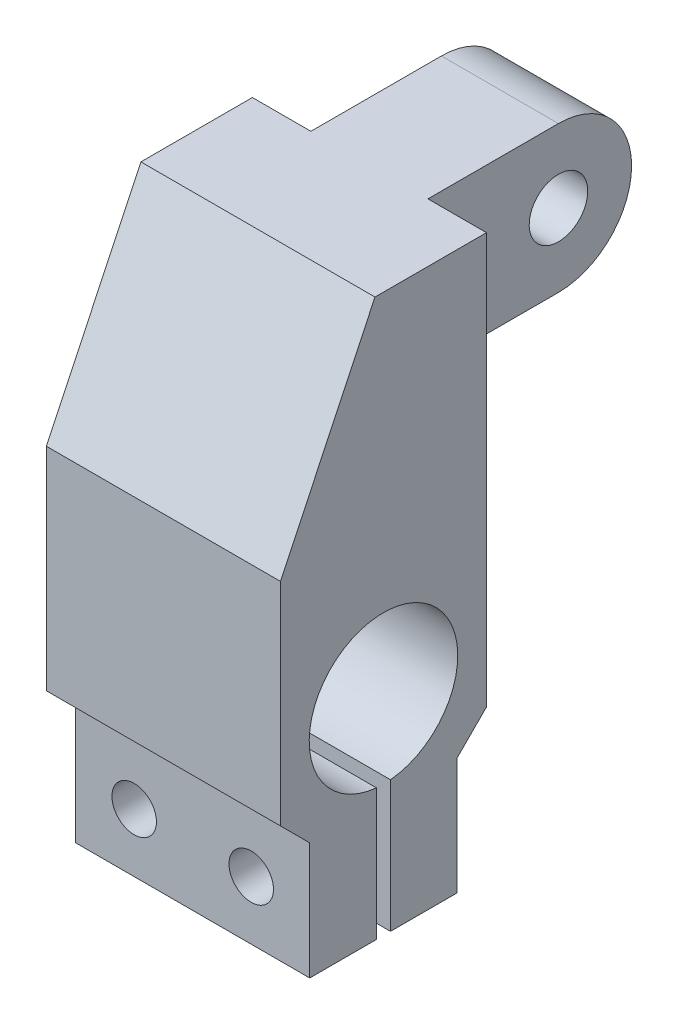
SolidWorks part; units mm, degrees
ref_plane "Plane1" through (0, 0, 0) normal (0, 0, 1) x (1, 0, 0)
ref_plane "Plane2" through (0, 0, 0) normal (0, 1, 0) x (1, 0, 0)
ref_plane "Plane3" through (0, 0, 0) normal (1, 0, 0) x (0, 0, -1)
sketch "Sketch1" plane through (0, 0, 0) normal (0, 0, 1) x (1, 0, 0)
  line L0 (0, 0) -> (25.4, 0)
  line L1 (0, 0) -> (0, 60.452)
  line L2 (25.4, 60.452) -> (0, 60.452)
  line L3 (25.4, 60.452) -> (25.4, 0)
  dimension "D1" = 25.4
  dimension "D2" = 60.452
extrude "Base-Extrude" add sketch "Sketch1" along normal blind 22.352
sketch "Sketch2" plane through (25.4, 0, 0) normal (1, 0, 0) x (0, 0, -1)
  line L0 (-12.9766, 58.6029) -> (-27.7372, 27.5171)
  line L1 (-27.7372, 27.5171) -> (-27.7372, 21.2602)
  line L2 (-27.7372, 21.2602) -> (-19.177, 12.7)
  line L3 (-19.177, 12.7) -> (-19.177, -3.6898)
  line L4 (-11.176, 0) -> (-11.176, 64.2807) construction
  line L5 (-22.352, 0) -> (0, 0) construction
  line L6 (-11.176, 0) -> (-11.176, -3.6898) construction
  line L7 (-22.352, 60.452) -> (0, 60.452) construction
  line L8 (-22.352, 60.452) -> (-22.352, 0) construction
  line L9 (-11.5072, 61.6974) -> (-35.0594, 61.6974)
  line L10 (-12.9766, 58.6029) -> (-11.7964, 61.0885)
  line L12 (11.4577, -3.6898) -> (-3.175, -3.6898)
  line L13 (-35.0594, 61.6974) -> (-33.8097, -3.6898)
  line L14 (-33.8097, -3.6898) -> (-19.177, -3.6898)
  line L15 (-3.175, 12.7) -> (-3.175, -3.6898)
  line L16 (-11.7964, 61.0885) -> (1.7437, 61.0885)
  line L17 (1.7437, 17.6187) -> (-3.175, 12.7)
  line L18 (12.7074, 61.6974) -> (11.4577, -3.6898)
  line L19 (-10.8448, 61.6974) -> (12.7074, 61.6974)
  line L20 (1.7437, 17.6187) -> (1.7437, 61.0885)
  line L21 (-10.8448, 61.6974) -> (-11.5072, 61.6974)
  circle A0 centre (-11.176, 22.2758) radius 8.0612
  dimension "D1" = 38.1762
  dimension "D2" = 25.4
  dimension "D3" = 3.175
  dimension "D4" = 12.7
extrude "Cut-Extrude1" cut sketch "Sketch2" against normal through all
sketch "Sketch3" plane through (25.4, 0, 0) normal (1, 0, 0) x (0, 0, -1)
  line L0 (-11.176, 22.2758) -> (-11.176, -3.2732) construction
  line L1 (-10.414, 15.875) -> (-10.414, -3.2732)
  line L2 (-11.938, 15.875) -> (-11.938, -3.2732)
  line L3 (-11.938, 15.875) -> (-10.414, 15.875)
  line L4 (-11.938, -3.2732) -> (-10.414, -3.2732)
  dimension "D1" = 0.762
extrude "Cut-Extrude2" cut sketch "Sketch3" against normal through all
sketch "Sketch4" plane through (0, 0, 0) normal (0, 0, -1) x (-1, 0, 0)
  line L0 (-12.7, 60.452) -> (-12.7, -4.3841) construction
  line L1 (-25.4, 60.452) -> (0, 60.452) construction
  line L2 (-19.05, 60.452) -> (-6.35, 60.452)
  line L3 (-19.05, 60.452) -> (-19.05, 44.577)
  line L4 (-6.35, 44.577) -> (-19.05, 44.577)
  line L5 (-6.35, 44.577) -> (-6.35, 60.452)
  dimension "D1" = 15.875
  dimension "D2" = 6.35
  dimension "D3" = 12.7
extrude "Boss-Extrude1" add sketch "Sketch4" along normal blind 22.098
sketch "Sketch5" plane through (19.05, 0, 0) normal (1, 0, 0) x (0, 0, -1)
  line L0 (22.098, 52.5145) -> (-4.0702, 52.5145) construction
  line L1 (22.098, 60.452) -> (22.098, 44.577) construction
  line L2 (14.1605, 44.577) -> (14.1605, 41.0095)
  line L3 (14.1605, 60.452) -> (14.1605, 62.4156)
  line L4 (14.1605, 62.4156) -> (23.0227, 62.4156)
  line L5 (23.0227, 62.4156) -> (23.0227, 41.0095)
  line L6 (23.0227, 41.0095) -> (14.1605, 41.0095)
  arc A0 (14.1605, 44.577) -> (14.1605, 60.452) centre (14.1605, 52.5145) ccw
  dimension "D1" = 15.875
extrude "Cut-Extrude3" cut sketch "Sketch5" against normal through all
sketch "Sketch6" plane through (19.05, 0, 0) normal (1, 0, 0) x (0, 0, -1)
  circle A0 centre (14.1605, 52.5145) radius 3.175
  dimension "D1" = 6.35
extrude "Cut-Extrude4" cut sketch "Sketch6" against normal through all
sketch "Sketch7" plane through (0, 0, 19.177) normal (0, 0, 1) x (1, 0, 0)
  line L0 (0, 6.35) -> (26.8634, 6.35) construction
  line L1 (0, 12.7) -> (0, 0) construction
  line L2 (25.4, 12.7) -> (25.4, 0) construction
  circle A0 centre (19.05, 6.35) radius 2.413
  circle A1 centre (6.35, 6.35) radius 2.413
  dimension "D1" = 4.826
  dimension "D2" = 4.826
  dimension "D3" = 6.35
  dimension "D4" = 6.35
extrude "Cut-Extrude5" cut sketch "Sketch7" against normal through all
